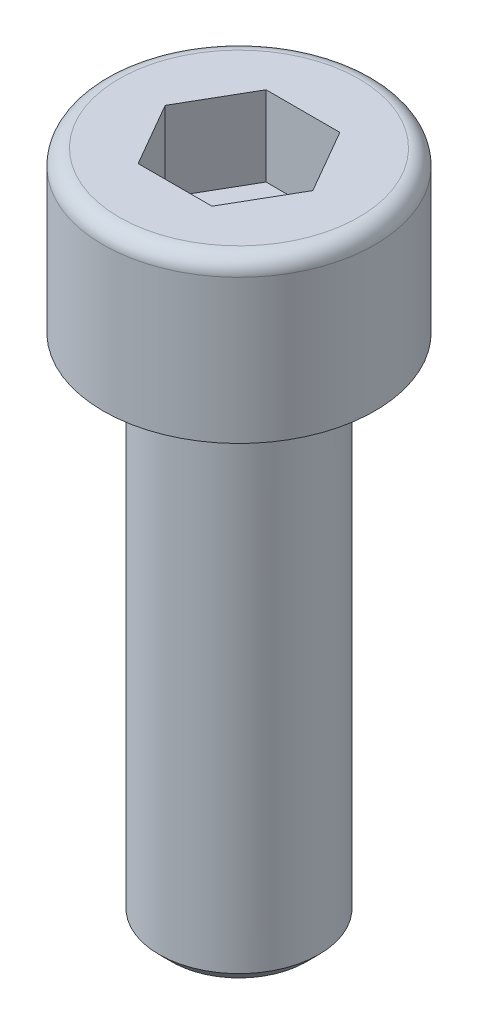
SolidWorks part; units mm, degrees
ref_plane "Plan1" through (0, 0, 0) normal (0, 0, 1) x (1, 0, 0)
ref_plane "Plan2" through (0, 0, 0) normal (0, 1, 0) x (1, 0, 0)
ref_plane "Plan3" through (0, 0, 0) normal (1, 0, 0) x (0, 0, -1)
sketch "Esquisse1" plane through (0, 0, 0) normal (0, 0, 1) x (1, 0, 0)
  line L0 (0, 23.8098) -> (0, -5.6276) construction
  line L1 (0, 21) -> (-3.75, 21)
  line L3 (-4.25, 20.5) -> (-4.25, 16)
  line L4 (-4.25, 16) -> (-2.5, 16)
  line L7 (-2.5, 16) -> (-2.5, 0)
  line L12 (-2.5, 0) -> (0, 0)
  line L13 (0, 21) -> (0, 0)
  arc A0 (-4.25, 20.5) -> (-3.75, 21) centre (-3.75, 20.5) cw
  dimension "D1" = 0.5
  dimension "D2" = 8.5
  dimension "D3" = 16
  dimension "D4" = 5
  dimension "D5" = 5
revolve "Base-Révolution" add sketch "Esquisse1" angle 360 about L0
sketch "Esquisse2" plane through (0, 21, 0) normal (0, 1, 0) x (-1, 0, 0)
  line L0 (2.3094, 0) -> (-2.3094, 0) construction
  line L1 (1.1547, 2) -> (-1.1547, -2) construction
  line L2 (1.1547, -2) -> (-1.1547, 2) construction
  line L3 (-1.1547, -2) -> (1.1547, -2)
  line L4 (1.1547, -2) -> (2.3094, 0)
  line L5 (2.3094, 0) -> (1.1547, 2)
  line L6 (1.1547, 2) -> (-1.1547, 2)
  line L7 (-1.1547, 2) -> (-2.3094, 0)
  line L8 (-2.3094, 0) -> (-1.1547, -2)
  dimension "D1" = 4
extrude "Enlèv. mat.-Extru.1" cut sketch "Esquisse2" against normal blind 2.5
chamfer "Chanfrein1" distance 0.4 angle 45
